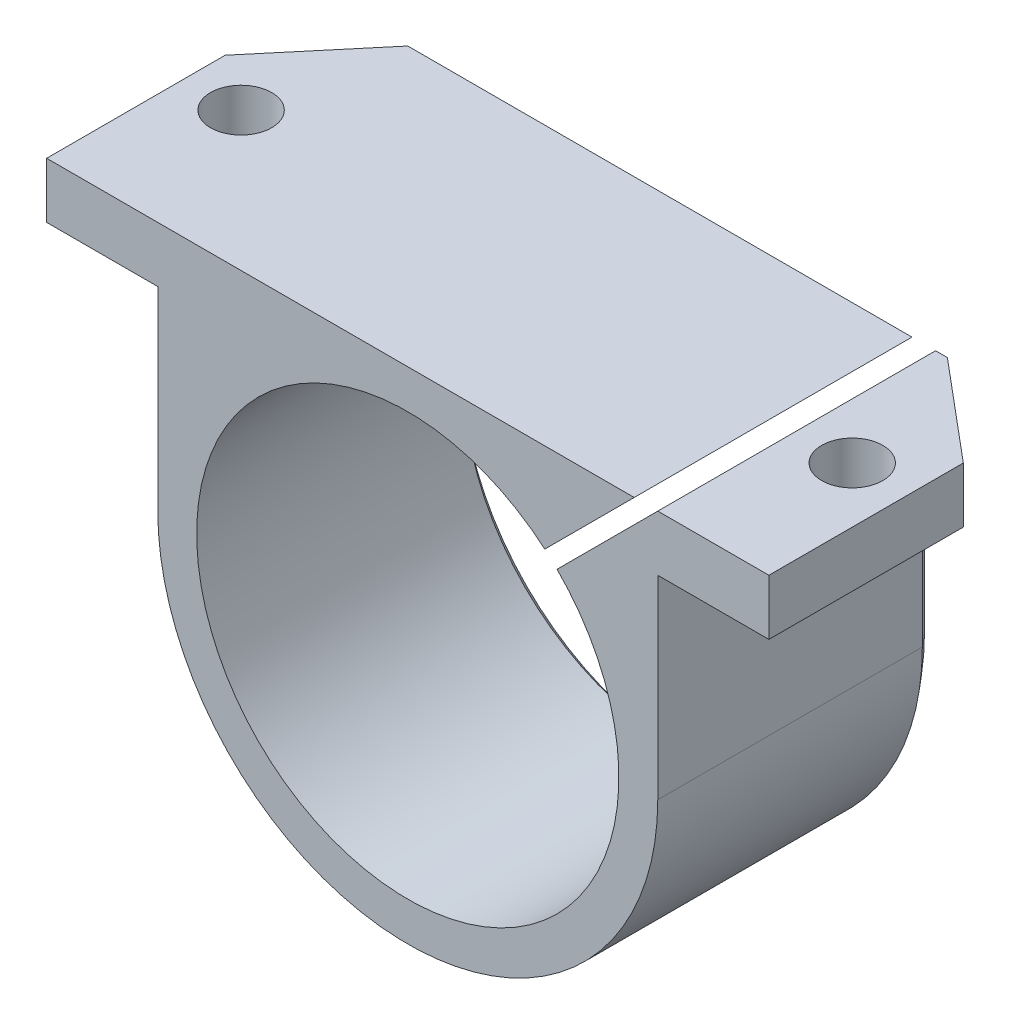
SolidWorks part; units mm, degrees
ref_plane "Front Plane" through (0, 0, 0) normal (0, 0, 1) x (1, 0, 0)
ref_plane "Top Plane" through (0, 0, 0) normal (0, 1, 0) x (1, 0, 0)
ref_plane "Right Plane" through (0, 0, 0) normal (1, 0, 0) x (0, 0, -1)
sketch "Sketch1" plane through (0, 0, 0) normal (0, 0, 1) x (1, 0, 0)
  line L0 (-32.5, 22.5) -> (32.5, 22.5)
  line L1 (32.5, 22.5) -> (32.5, 17.5)
  line L2 (32.5, 17.5) -> (22.5, 17.5)
  line L3 (22.5, 17.5) -> (22.5, 0)
  line L4 (-32.5, 22.5) -> (-32.5, 17.5)
  line L5 (-32.5, 17.5) -> (-22.5, 17.5)
  line L6 (-22.5, 17.5) -> (-22.5, 0)
  line L7 (0, 0) -> (-2.1213, 0)
  line L8 (-2.1213, 0) -> (20.3787, 22.5)
  line L9 (0, 0) -> (22.5, 22.5)
  line L10 (0, 0) -> (0, 22.5) construction
  circle A0 centre (0, 0) radius 19
  circle A1 centre (0, 0) radius 22.5
  dimension "D2" = 38
  dimension "D4" = 3.5
  dimension "D1" = 1.5
  dimension "D3" = 45
  dimension "D5" = 10
  dimension "D6" = 5
  dimension "D7" = 5
  dimension "D8" = 10
extrude "Boss-Extrude1" add sketch "Sketch1" along normal mid plane 25 contours A0 L10 A1 L9 | L10 A0 L8 A1 | A1 L8 L0 | A1 L3 L2 L1 L0 L9 | A1 L0 L4 L5 L6
sketch "Sketch2" plane through (0, 22.5, 0) normal (0, 1, 0) x (1, 0, 0)
  line L0 (-32.5, 12.5) -> (-22.5, 12.5) construction
  line L1 (-22.5, 12.5) -> (-22.5, -12.5) construction
  line L2 (-22.5, -12.5) -> (-32.5, -12.5) construction
  line L3 (-32.5, -12.5) -> (-32.5, 12.5) construction
  line L4 (22.5, 12.5) -> (32.5, 12.5) construction
  line L5 (32.5, 12.5) -> (32.5, -12.5) construction
  line L6 (32.5, -12.5) -> (22.5, -12.5) construction
  line L7 (22.5, -12.5) -> (22.5, 12.5) construction
  line L8 (-32.5, 12.5) -> (-22.5, 12.5)
  line L9 (-22.5, 12.5) -> (-22.5, -12.5)
  line L10 (-22.5, -12.5) -> (-32.5, -12.5)
  line L11 (-32.5, -12.5) -> (-32.5, 12.5)
  line L12 (22.5, 12.5) -> (32.5, 12.5)
  line L13 (32.5, 12.5) -> (32.5, -12.5)
  line L14 (32.5, -12.5) -> (22.5, -12.5)
  line L15 (22.5, -12.5) -> (22.5, 12.5)
  line L16 (27.5, 12.5) -> (27.5, -12.5) construction
  line L17 (-27.5, -12.5) -> (-27.5, 12.5) construction
  circle A0 centre (27.5, 0) radius 2.75
  circle A1 centre (-27.5, 0) radius 2.75
  point P10 (27.5, 0)
  point P12 (-27.5, 0)
  dimension "D1" = 5.5
extrude "Cut-Extrude1" cut sketch "Sketch2" against normal through all contours A0 | A1
chamfer "Chamfer1" distance 7.5 angle 50 2 edges at (32.5, 20, -12.5) (-32.5, 20, -12.5)
chamfer "Chamfer2" distance 1 angle 50 4 edges at (-12.8938, -13.9553, -12.5) (-22.5, 8.75, -12.5) (22.5, 8.75, -12.5) (0, -22.5, -12.5)
